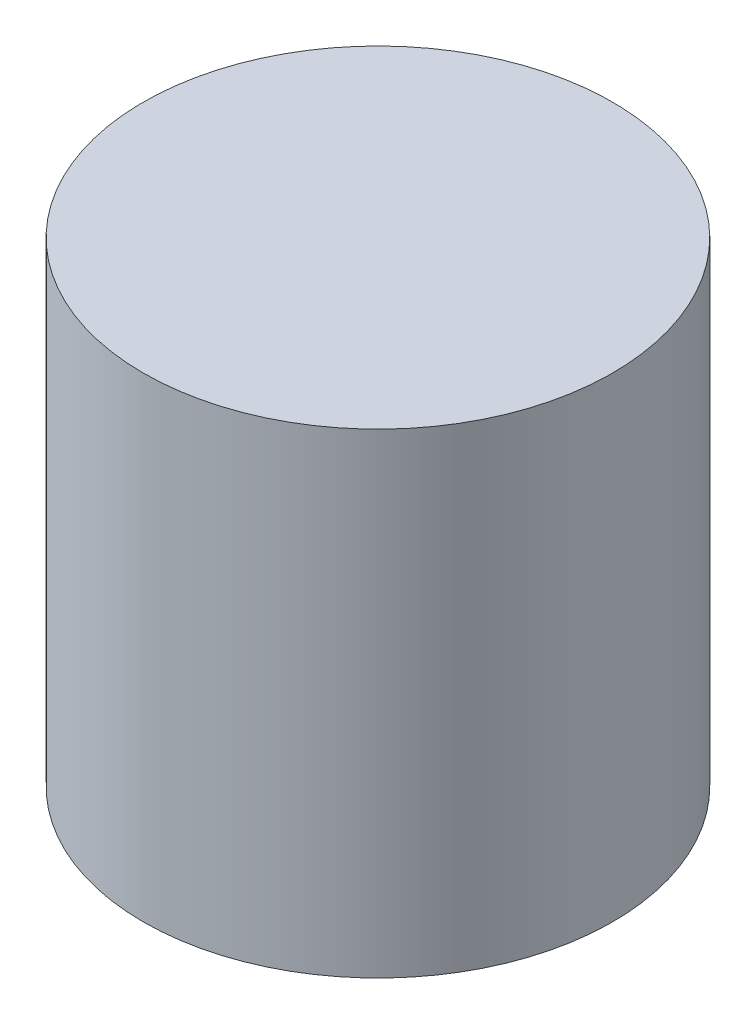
SolidWorks part; units mm, degrees
ref_plane "Front" through (0, 0, 0) normal (0, 0, 1) x (1, 0, 0)
ref_plane "Top" through (0, 0, 0) normal (0, 1, 0) x (1, 0, 0)
ref_plane "Right" through (0, 0, 0) normal (1, 0, 0) x (0, 0, -1)
sketch "Sketch1"
extrude "Extrude1" add sketch "Sketch1" along normal blind 78.74
